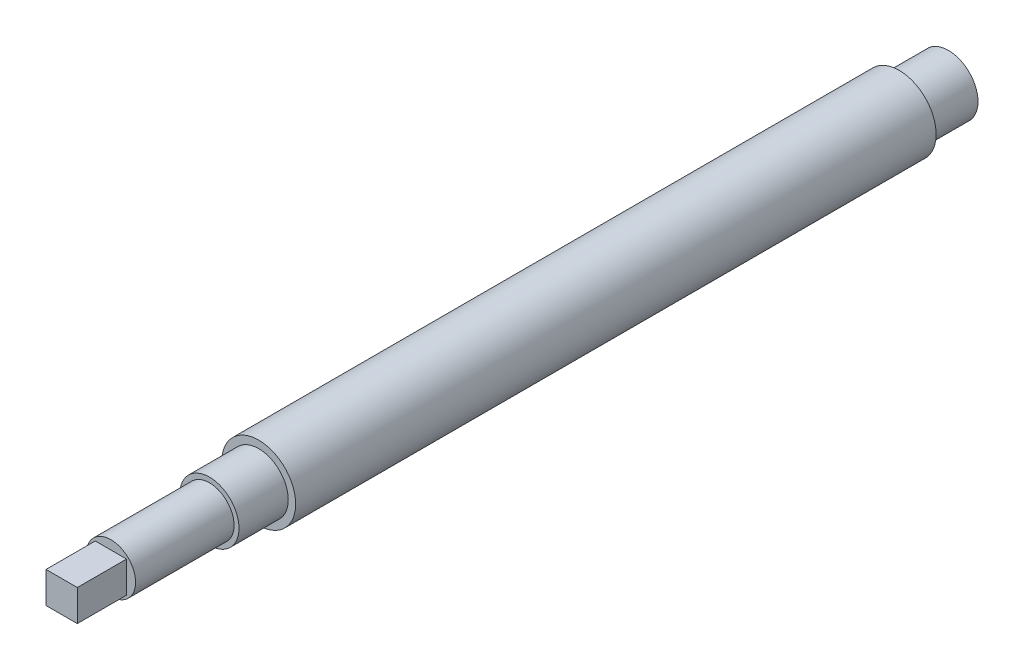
SolidWorks part; units mm, degrees
ref_plane "Alzado" through (0, 0, 0) normal (0, 0, 1) x (1, 0, 0)
ref_plane "Planta" through (0, 0, 0) normal (0, 1, 0) x (1, 0, 0)
ref_plane "Vista lateral" through (0, 0, 0) normal (1, 0, 0) x (0, 0, -1)
sketch "Croquis1" plane through (0, 0, 0) normal (0, 0, 1) x (1, 0, 0)
  circle A0 centre (0, 0) radius 7.5
extrude "Extruir2" add sketch "Croquis1" along normal blind 130
sketch "Croquis3" plane through (0, 0, 130) normal (0, 0, 1) x (1, 0, 0)
  circle A0 centre (0, 0) radius 6
extrude "Extruir3" add sketch "Croquis3" along normal blind 10
sketch "Croquis4" plane through (0, 0, 0) normal (0, 0, -1) x (-1, 0, 0)
  circle A0 centre (0, 0) radius 6
extrude "Extruir4" add sketch "Croquis4" along normal blind 10
sketch "Croquis5" plane through (0, 0, 140) normal (0, 0, 1) x (1, 0, 0)
  circle A0 centre (0, 0) radius 5
extrude "Extruir5" add sketch "Croquis5" along normal blind 20
sketch "Croquis6" plane through (0, 0, 160) normal (0, 0, 1) x (1, 0, 0)
  line L1 (-3.175, 3.175) -> (3.175, 3.175)
  line L2 (-3.175, 3.175) -> (-3.175, -3.175)
  line L3 (-3.175, -3.175) -> (3.175, -3.175)
  line L4 (3.175, 3.175) -> (3.175, -3.175)
extrude "Extruir6" add sketch "Croquis6" along normal blind 10
